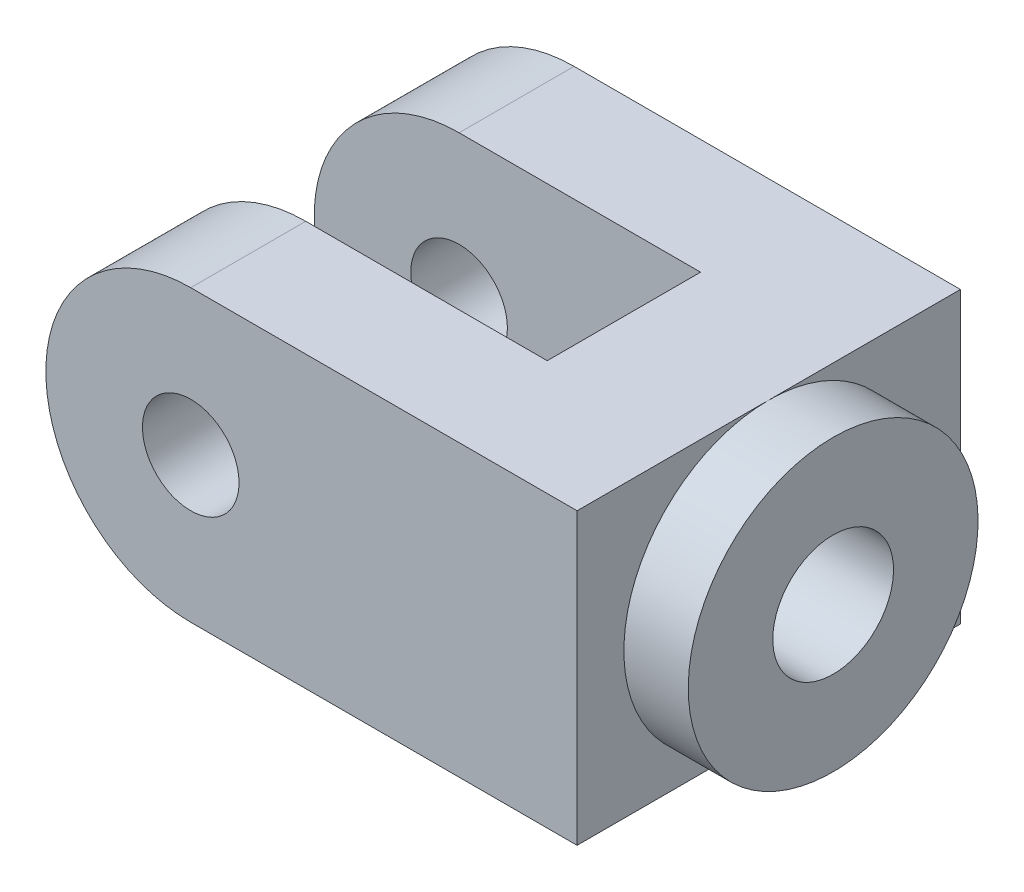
SolidWorks part; units mm, degrees
ref_plane "Front Plane" through (0, 0, 0) normal (0, 0, 1) x (1, 0, 0)
ref_plane "Top Plane" through (0, 0, 0) normal (0, 1, 0) x (1, 0, 0)
ref_plane "Right Plane" through (0, 0, 0) normal (1, 0, 0) x (0, 0, -1)
sketch "Sketch1" plane through (0, 0, 0) normal (0, 0, 1) x (1, 0, 0)
  line L1 (-66, 36) -> (66, 36)
  line L2 (-66, 36) -> (-66, -36)
  line L3 (-66, -36) -> (66, -36)
  line L4 (66, 36) -> (66, -36)
  line L5 (-66, 36) -> (66, -36) construction
  line L6 (-66, -36) -> (66, 36) construction
  point P0 (0, 0)
  dimension "D1" = 132
  dimension "D2" = 72
extrude "Boss-Extrude1" add sketch "Sketch1" along normal mid plane 95.25
sketch "Sketch2" plane through (0, 0, 47.625) normal (0, 0, 1) x (1, 0, 0)
  line L0 (66, 36) -> (-66, 36) construction
  line L1 (-66, -36) -> (66, -36) construction
  line L2 (-66, 36) -> (-66, -36) construction
  arc A0 (-30, 36) -> (-30, -36) centre (-30, 0) ccw
  dimension "D1" = 36
extrude "Cut-Extrude1" cut sketch "Sketch2" against normal through all and the other way through all flip side to cut
sketch "Sketch3" plane through (0, 36, 0) normal (0, 1, 0) x (1, 0, 0)
  line L0 (-66, 47.625) -> (-66, -47.625) construction
  line L1 (-66, 19.055) -> (30, 19.055)
  line L2 (-66, 19.055) -> (-66, -19.045)
  line L3 (-66, -19.045) -> (30, -19.045)
  line L4 (30, 19.055) -> (30, -19.045)
  line L5 (-66, 19.055) -> (30, -19.045) construction
  line L6 (-66, -19.045) -> (30, 19.055) construction
  line L7 (-30, -47.625) -> (-30, 47.625) construction
  point P0 (-18, 0.005)
  dimension "D1" = 38.1
  dimension "D2" = 60
  dimension "D3" = 28.58
extrude "Cut-Extrude2" cut sketch "Sketch3" against normal through all
sketch "Sketch4" plane through (66, 0, 0) normal (1, 0, 0) x (0, 0, -1)
  circle A0 centre (0, 0) radius 15
  dimension "D1" = 30
extrude "Cut-Extrude3" cut sketch "Sketch4" against normal through all
sketch "Sketch5" plane through (66, 0, 0) normal (1, 0, 0) x (0, 0, -1)
  circle A0 centre (0, 0) radius 36
  circle A1 centre (0, 0) radius 15 construction
  circle A2 centre (0, 0) radius 15
  dimension "D1" = 72
extrude "Boss-Extrude2" add sketch "Sketch5" along normal blind 16
sketch "Sketch6" plane through (0, 0, 47.625) normal (0, 0, 1) x (1, 0, 0)
  circle A0 centre (-30, 0) radius 12
  arc A1 (-30, 36) -> (-30, -36) centre (-30, 0) ccw construction
  dimension "D1" = 24
extrude "Cut-Extrude4" cut sketch "Sketch6" against normal through all
